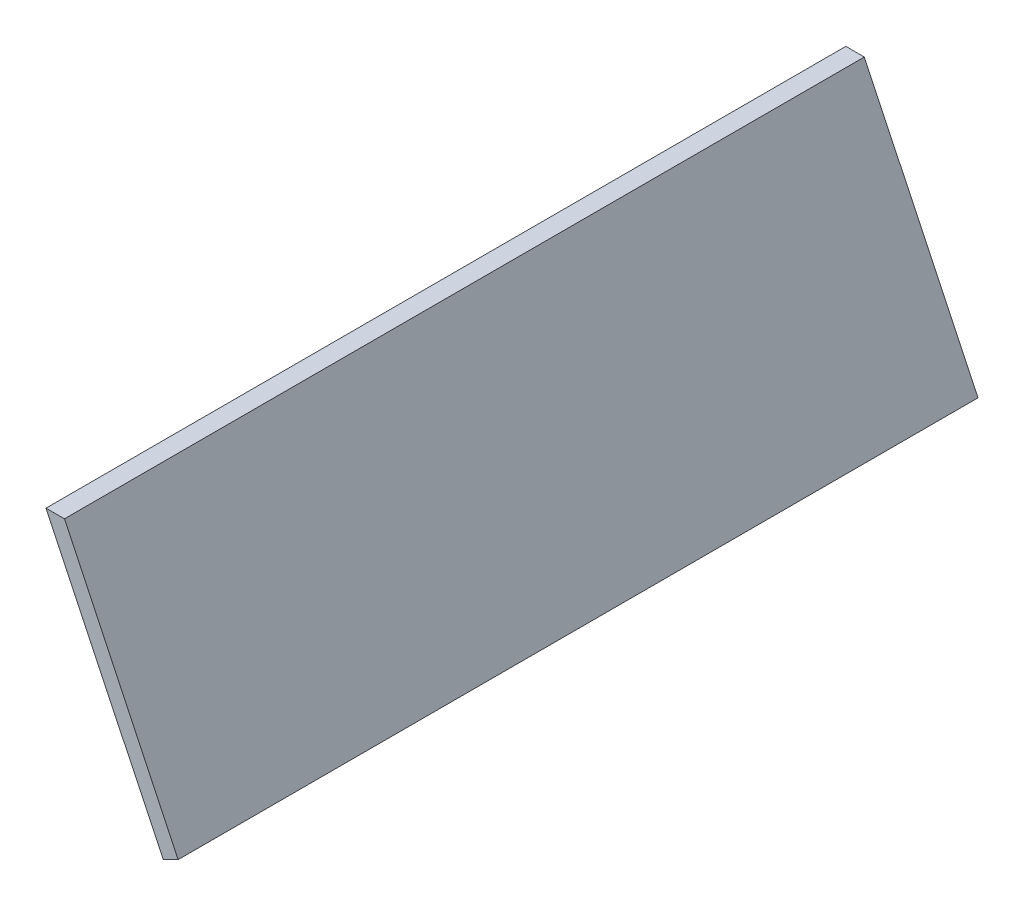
SolidWorks part; units mm, degrees
ref_plane "Front Plane" through (0, 0, 0) normal (0, 0, 1) x (1, 0, 0)
ref_plane "Top Plane" through (0, 0, 0) normal (0, 1, 0) x (1, 0, 0)
ref_plane "Right Plane" through (0, 0, 0) normal (1, 0, 0) x (0, 0, -1)
ref_plane "Front Plane-Bucket_Floor" through (0, 0, 0) normal (0, 0, 1) x (1, 0, 0)
ref_plane "Top Plane-Bucket_Floor" through (0, 0, 0) normal (0, 1, 0) x (1, 0, 0)
ref_plane "Right Plane-Bucket_Floor" through (0, 0, 0) normal (1, 0, 0) x (0, 0, -1)
sketch "Sketch1-Bucket_Floor" plane through (0, 0, 0) normal (0, 0, 1) x (1, 0, 0)
  line L0 (-50.546, 21.0608) -> (-72.8591, 67.8392)
  line L1 (50.546, -21.0608) -> (-50.546, -21.0608)
  line L2 (50.546, -21.0608) -> (50.546, 21.0608)
  line L4 (-50.546, -21.0608) -> (-50.546, 21.0608)
  line L5 (50.546, -21.0608) -> (-50.546, 21.0608) construction
  line L6 (50.546, 21.0608) -> (-50.546, -21.0608) construction
  line L7 (-72.8591, 67.8392) -> (72.8591, 67.8392)
  line L8 (72.8591, 67.8392) -> (50.546, 21.0608)
  point P0 (0, 0)
  dimension "D1" = 101.092
  dimension "D2" = 88.9
  dimension "D3" = 205.501
  dimension "D4" = 42.1217
inserted part "Bucket_Floor"
sketch "Sketch2" plane through (0, 0, 0) normal (0, 0, 1) x (1, 0, 0)
  line L0 (-72.8591, 67.8392) -> (-50.546, 21.0608)
  line L1 (-50.546, 21.0608) -> (-47.6803, 22.4278)
  line L2 (-47.6803, 22.4278) -> (-69.3414, 67.8392)
  line L3 (-72.8591, 67.8392) -> (72.8591, 67.8392) construction
  line L4 (-69.3414, 67.8392) -> (-72.8591, 67.8392)
  dimension "D1" = 3.175
extrude "Boss-Extrude1" add sketch "Sketch2" along normal blind 152.4
